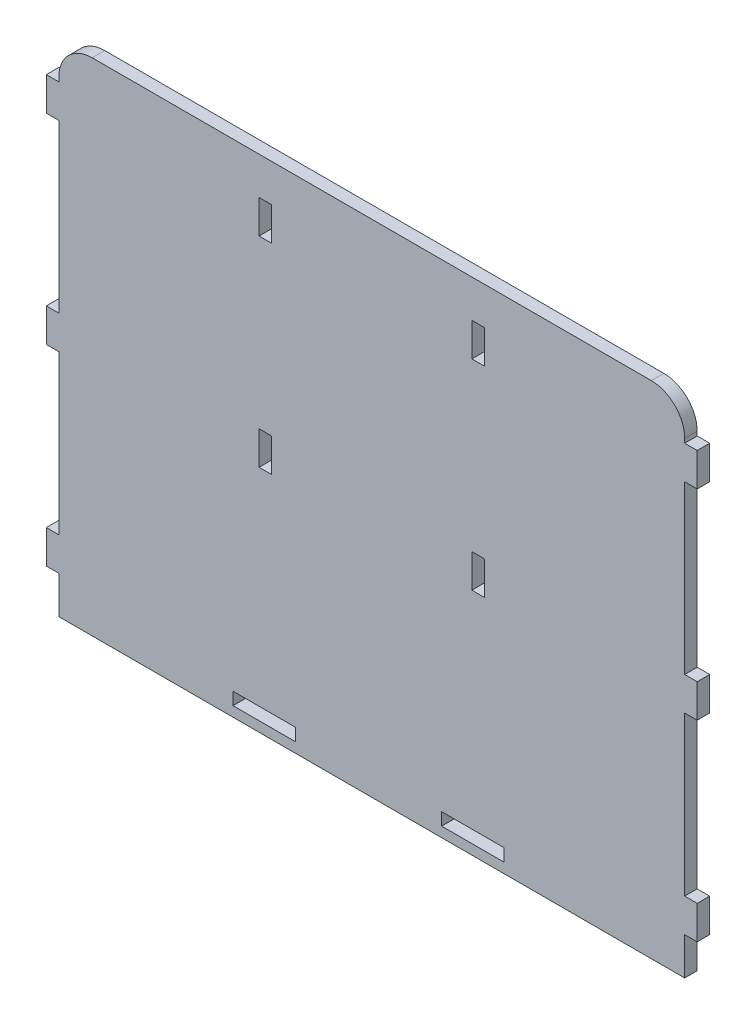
SolidWorks part; units mm, degrees
ref_plane "Front Plane" through (0, 0, 0) normal (0, 0, 1) x (1, 0, 0)
ref_plane "Top Plane" through (0, 0, 0) normal (0, 1, 0) x (1, 0, 0)
ref_plane "Right Plane" through (0, 0, 0) normal (1, 0, 0) x (0, 0, -1)
sketch "Croquis1" plane through (0, 0, 0) normal (0, 0, 1) x (1, 0, 0)
  line L0 (-375, -45) -> (-390, -45)
  line L1 (-375, 0) -> (375, 0)
  line L2 (-375, 0) -> (-375, -45)
  line L3 (-375, -600) -> (375, -600)
  line L4 (375, 0) -> (375, -45)
  line L5 (-390, -45) -> (-390, -85)
  line L6 (-390, -85) -> (-375, -85)
  line L10 (-375, -515) -> (-390, -515)
  line L11 (-390, -515) -> (-390, -555)
  line L12 (-390, -555) -> (-375, -555)
  line L16 (0, 0) -> (0, -860.716) construction
  line L17 (-375, -325) -> (-390, -325)
  line L19 (-375, -285) -> (-390, -285)
  line L20 (-390, -325) -> (-390, -285)
  line L21 (390, -555) -> (375, -555)
  line L22 (390, -515) -> (390, -555)
  line L23 (375, -515) -> (390, -515)
  line L24 (375, -325) -> (390, -325)
  line L25 (390, -325) -> (390, -285)
  line L26 (375, -285) -> (390, -285)
  line L27 (390, -85) -> (375, -85)
  line L28 (390, -45) -> (390, -85)
  line L29 (375, -45) -> (390, -45)
  line L30 (-375, -85) -> (-375, -285)
  line L31 (-375, -325) -> (-375, -515)
  line L32 (-375, -555) -> (-375, -600)
  line L33 (375, -85) -> (375, -285)
  line L34 (375, -325) -> (375, -515)
  line L35 (375, -555) -> (375, -600)
  dimension "D2" = 600
  dimension "D3" = 600
  dimension "D4" = 375
  dimension "D5" = 15
  dimension "D6" = 275
  dimension "D7" = 15
  dimension "D8" = 40
  dimension "D9" = 15
  dimension "D10" = 40
  dimension "D11" = 45
  dimension "D12" = 45
  dimension "D13" = 40
extrude "Saliente-Extruir1" add sketch "Croquis1" along normal blind 15
fillet "Redondeo1" radius 40 1 edges at (-375, 0, 7.5)
fillet "Redondeo2" radius 40 1 edges at (375, 0, 7.5)
sketch "Croquis2" plane through (0, 0, 15) normal (0, 0, 1) x (1, 0, 0)
  line L2 (-375, -85) -> (-375, -285) construction
  line L3 (-135, -45) -> (-120, -45)
  line L4 (-135, -45) -> (-135, -85)
  line L5 (-135, -85) -> (-120, -85)
  line L6 (-120, -45) -> (-120, -85)
  line L7 (120, -45) -> (135, -45)
  line L8 (120, -45) -> (120, -85)
  line L9 (120, -85) -> (135, -85)
  line L10 (135, -45) -> (135, -85)
  line L19 (375, -285) -> (375, -85) construction
  line L20 (335, 0) -> (-335, 0) construction
  line L23 (-135, -285) -> (-120, -285)
  line L24 (-135, -285) -> (-135, -325)
  line L25 (-135, -325) -> (-120, -325)
  line L26 (-120, -285) -> (-120, -325)
  line L27 (120, -285) -> (135, -285)
  line L28 (120, -285) -> (120, -325)
  line L29 (120, -325) -> (135, -325)
  line L30 (135, -285) -> (135, -325)
  dimension "D1" = 240
  dimension "D2" = 15
  dimension "D3" = 15
  dimension "D4" = 40
  dimension "D5" = 40
  dimension "D6" = 240
  dimension "D7" = 240
  dimension "D8" = 45
  dimension "D9" = 285
  dimension "D10" = 40
  dimension "D11" = 15
  dimension "D12" = 40
  dimension "D13" = 15
  dimension "D14" = 285
extrude "Cortar-Extruir1" cut sketch "Croquis2" against normal up to next
sketch "Croquis3" plane through (0, 0, 15) normal (0, 0, 1) x (1, 0, 0)
  line L0 (-375, -555) -> (-375, -600) construction
  line L1 (-166.25, -573) -> (-91.25, -573)
  line L2 (-166.25, -573) -> (-166.25, -588)
  line L3 (-166.25, -588) -> (-91.25, -588)
  line L4 (-91.25, -573) -> (-91.25, -588)
  line L5 (83.75, -573) -> (158.75, -573)
  line L6 (83.75, -573) -> (83.75, -588)
  line L7 (83.75, -588) -> (158.75, -588)
  line L8 (158.75, -573) -> (158.75, -588)
  line L9 (-375, -600) -> (375, -600) construction
  point P10 (-375, -577.5)
  dimension "D1" = 75
  dimension "D2" = 175
  dimension "D3" = 208.75
  dimension "D4" = 15
  dimension "D5" = 15
  dimension "D6" = 12
  dimension "D7" = 75
extrude "Cortar-Extruir2" cut sketch "Croquis3" against normal up to next
